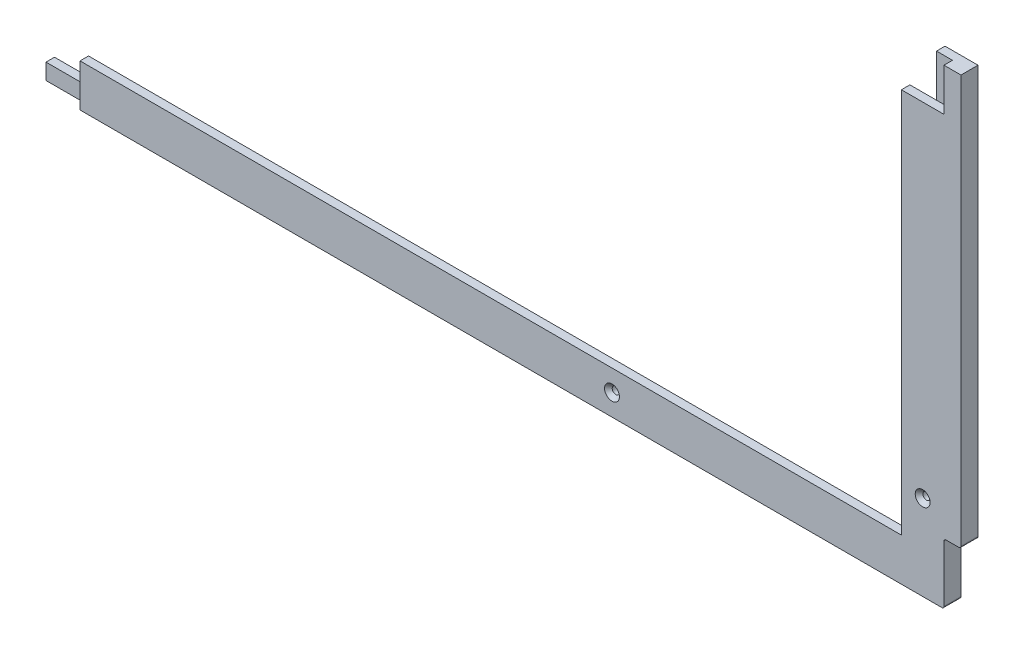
SolidWorks part; units mm, degrees
ref_plane "Ebene vorne" through (0, 0, 0) normal (0, 0, 1) x (1, 0, 0)
ref_plane "Ebene oben" through (0, 0, 0) normal (0, 1, 0) x (1, 0, 0)
ref_plane "Ebene rechts" through (0, 0, 0) normal (1, 0, 0) x (0, 0, -1)
sketch "Skizze1" plane through (0, 0, 0) normal (0, 0, 1) x (1, 0, 0)
  line L1 (-396, -191.25) -> (396, -191.25)
  line L2 (-396, -191.25) -> (-396, 191.25)
  line L3 (-396, 191.25) -> (396, 191.25)
  line L4 (396, -191.25) -> (396, 191.25)
  line L5 (-396, -191.25) -> (396, 191.25) construction
  line L6 (-396, 191.25) -> (396, -191.25) construction
  line L7 (-416, -211.25) -> (416, -211.25)
  line L8 (-416, -211.25) -> (-416, 211.25)
  line L9 (-416, 211.25) -> (416, 211.25)
  line L10 (416, -211.25) -> (416, 211.25)
  line L11 (-416, -211.25) -> (416, 211.25) construction
  line L12 (-416, 211.25) -> (416, -211.25) construction
  point P0 (0, 0)
  point P6 (0, 0)
  dimension "D1" = 832
  dimension "D2" = 422.5
  dimension "D3" = 20
  dimension "D4" = 20
extrude "Aufsatz-Linear austragen1" add sketch "Skizze1" along normal blind 8
fillet "Verrundung1" radius 1 4 edges at (-416, 211.25, 4) (-416, -211.25, 4) (416, -211.25, 4) (416, 211.25, 4)
sketch "Skizze2" plane through (0, 0, 0) normal (0, 0, -1) x (-1, 0, 0)
  line L0 (-416, -210.25) -> (-416, 210.25) construction
  line L1 (-408.5, 203.75) -> (408.5, 203.75)
  line L2 (-408.5, 203.75) -> (-408.5, -203.75)
  line L3 (-408.5, -203.75) -> (408.5, -203.75)
  line L4 (408.5, 203.75) -> (408.5, -203.75)
  line L5 (-415, 211.25) -> (415, 211.25) construction
  line L6 (416, 210.25) -> (416, -210.25) construction
  line L7 (415, -211.25) -> (-415, -211.25) construction
  dimension "D1" = 7.5
  dimension "D2" = 7.5
  dimension "D3" = 7.5
  dimension "D4" = 7.5
extrude "Schnitt-Linear austragen1" cut sketch "Skizze2" against normal blind 4
hole_wizard "Formsenkung für M3 Senkschraube mit Innensechskant1" positions "Skizze3" profile "Skizze4" countersink size "M3" standard "DIN"
sketch "Skizze3" plane through (0, 0, 8) normal (0, 0, 1) x (1, 0, 0)
  line L0 (-416, 210.25) -> (-416, -210.25) construction
  line L1 (416, -210.25) -> (416, 210.25) construction
  line L2 (-415, -211.25) -> (415, -211.25) construction
  line L3 (415, 211.25) -> (-415, 211.25) construction
  point P0 (-260, -201.25)
  point P2 (260, -201.25)
  point P4 (260, 201.25)
  point P6 (-260, 201.25)
  point P8 (406, 171.25)
  point P10 (406, -171.25)
  point P12 (-406, -171.25)
  point P14 (-406, 171.25)
  point P26 (-406, 0)
  point P32 (406, 0)
  point P37 (0, -201.25)
  point P39 (0, 201.25)
  dimension "D1" = 156
  dimension "D2" = 156
  dimension "D3" = 10
  dimension "D4" = 10
  dimension "D5" = 10
  dimension "D6" = 10
  dimension "D7" = 40
  dimension "D8" = 40
sketch "Skizze4" plane through (-260, -201.25, 8) normal (1, 0, 0) x (0, -1, 0)
  line L0 (0, 0) -> (0, 8)
  line L1 (0, 8) -> (1.7, 8)
  line L2 (1.7, 8) -> (1.7, 1.8)
  line L3 (1.7, 1.8) -> (3.5, 0)
  line L5 (3.5, 0) -> (0, 0)
  line L6 (-1.7, 1.8) -> (-3.5, 0) construction
  line L11 (0, -6.35) -> (0, 107.95) construction
  dimension "Bohrerdurchmesser" = 3.4
  dimension "Bohrungstiefe" = 8
  dimension "Senkdurchmesser (Oben)" = 7
  dimension "Senkwinkel (Oben)" = 90
sketch "Skizze5" plane through (0, 0, 0) normal (1, 0, 0) x (0, 0, -1)
  line L0 (-8, 211.25) -> (-8, -10)
  line L1 (-8, -210.25) -> (-8, 210.25) construction
  line L2 (-8, -10) -> (-4, -10)
  line L3 (-4, -10) -> (-4, 10)
  line L4 (-4, 10) -> (0, 10)
  line L5 (0, -210.25) -> (0, 210.25) construction
  line L6 (0, 10) -> (0, 211.25)
  line L7 (0, 211.25) -> (-8, 211.25)
  dimension "D1" = 10
  dimension "D2" = 10
  dimension "D3" = 4
extrude "Schnitt-Linear austragen2" cut sketch "Skizze5" along normal through all
sketch "Skizze6" plane through (0, 0, 0) normal (1, 0, 0) x (0, 0, -1)
  line L0 (-8, 211.25) -> (-8, -10)
  line L1 (-8, -210.25) -> (-8, -10) construction
  line L2 (-8, -10) -> (-4, -10)
  line L3 (-4, -10) -> (-4, 10)
  line L4 (-4, 10) -> (0, 10)
  line L5 (0, -210.25) -> (0, 10) construction
  line L6 (0, 10) -> (0, 211.25)
  line L7 (0, 211.25) -> (-8, 211.25)
  line L8 (-8, 211.25) -> (-8, 204.75) construction
  dimension "D1" = 10
  dimension "D2" = 4
  dimension "D3" = 10
extrude "Schnitt-Linear austragen3" cut sketch "Skizze6" against normal through all
sketch "Skizze7" plane through (0, 0, 0) normal (0, 1, 0) x (1, 0, 0)
  line L9 (-416, -8) -> (-416, 0)
  line L10 (-416, 0) -> (-10, 0)
  line L11 (408.5, 0) -> (-408.5, 0) construction
  line L12 (-10, 0) -> (-10, -4)
  line L13 (396, -4) -> (-396, -4) construction
  line L14 (-10, -4) -> (10, -4)
  line L15 (408.5, -4) -> (-408.5, -4) construction
  line L16 (10, -4) -> (10, -8)
  line L17 (-396, -8) -> (396, -8) construction
  line L18 (10, -8) -> (-416, -8)
  dimension "D1" = 10
  dimension "D2" = 10
extrude "Schnitt-Linear austragen4" cut sketch "Skizze7" against normal through all both and the other way through all
sketch "Skizze8" plane through (0, 0, 0) normal (0, 0, -1) x (-1, 0, 0)
  line L0 (10, -211.25) -> (-415, -211.25) construction
  line L1 (-416, 10) -> (-424, 10)
  line L2 (-416, 10) -> (-416, -182.75)
  line L3 (-416, -182.75) -> (-424, -182.75)
  line L4 (-424, 10) -> (-424, -182.75)
  dimension "D1" = 28.5
  dimension "D2" = 8
extrude "Aufsatz-Linear austragen2" add sketch "Skizze8" against normal up to surface (8 mm away)
fillet "Verrundung2" radius 1 2 edges at (424, -182.75, 4) (416, -182.75, 4)
